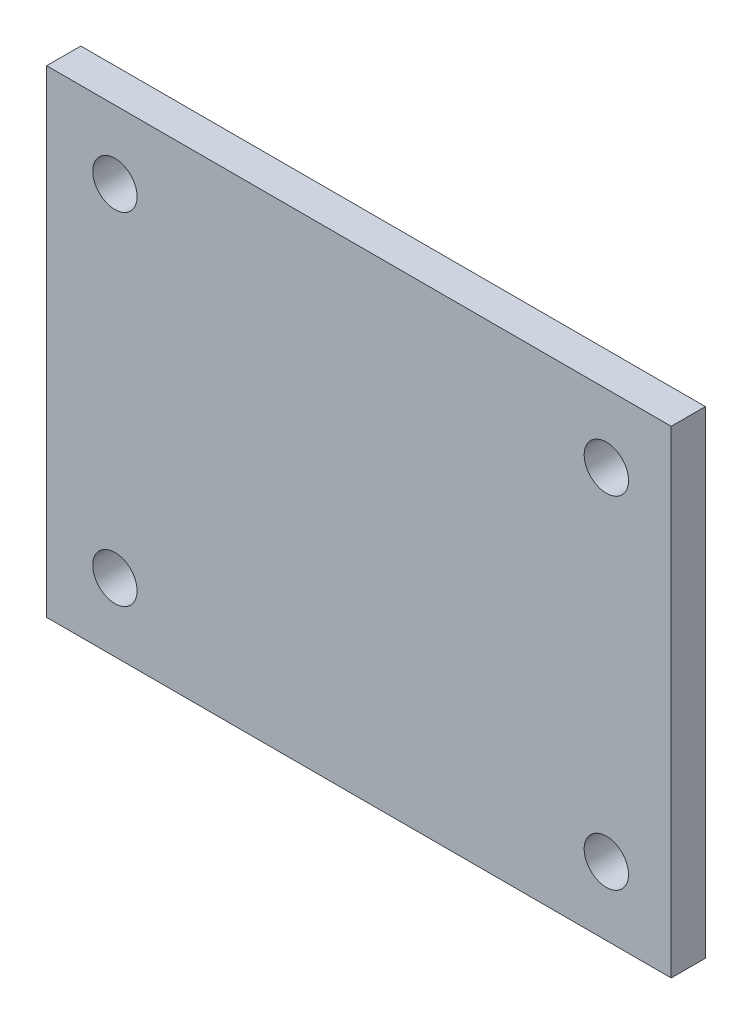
SolidWorks part; units mm, degrees
ref_plane "Plan1" through (0, 0, 0) normal (0, 0, 1) x (1, 0, 0)
ref_plane "Plan2" through (0, 0, 0) normal (0, 1, 0) x (1, 0, 0)
ref_plane "Plan3" through (0, 0, 0) normal (1, 0, 0) x (0, 0, -1)
sketch "Esquisse1" plane through (0, 0, 0) normal (0, 0, 1) x (1, 0, 0)
  line L1 (0, 0) -> (183, 0)
  line L2 (0, 0) -> (0, 140)
  line L3 (0, 140) -> (183, 140)
  line L4 (183, 0) -> (183, 140)
  dimension "D1" = 140
  dimension "D2" = 183
extrude "Extrusion1" add sketch "Esquisse1" along normal blind 10
sketch "Esquisse2" plane through (0, 0, 10) normal (0, 0, 1) x (1, 0, 0)
  line L0 (0, 0) -> (183, 0) construction
  line L1 (0, 140) -> (0, 0) construction
  circle A0 centre (20, 20) radius 6.5
  dimension "D1" = 13
  dimension "D2" = 20
  dimension "D3" = 20
extrude "Enlèv. mat.-Extru.1" cut sketch "Esquisse2" against normal through all
pattern_linear "Répétition linéaire1" count 2 spacing 100 count 2 spacing 144
